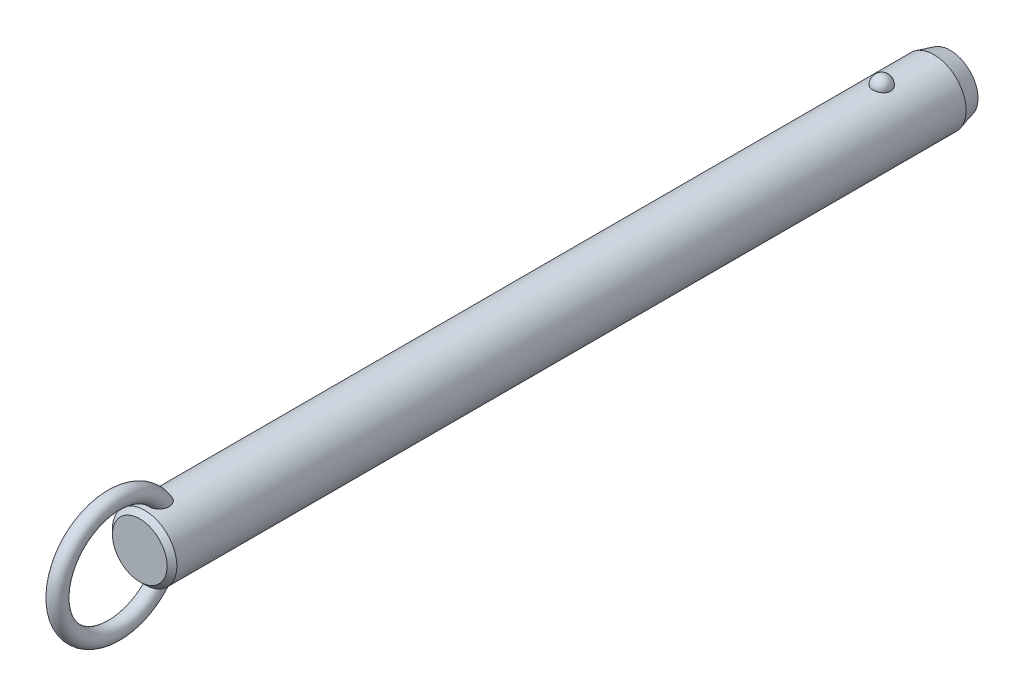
SolidWorks part; units mm, degrees
ref_plane "Front Plane" through (0, 0, 0) normal (0, 0, 1) x (1, 0, 0)
ref_plane "Top Plane" through (0, 0, 0) normal (0, 1, 0) x (1, 0, 0)
ref_plane "Right Plane" through (0, 0, 0) normal (1, 0, 0) x (0, 0, -1)
sketch "Sketch2" plane through (0, 0, 0) normal (0, 0, 1) x (1, 0, 0)
  circle A0 centre (0, 0) radius 7.9
  point P3 (0, 7.9)
  dimension "D1" = 15.8
extrude "Boss-Extrude1" add sketch "Sketch2" along normal blind 170.2
sketch "Sketch3" plane through (0, 0, 0) normal (0, 0, -1) x (-1, 0, 0)
  circle A0 centre (0, 0) radius 7.9
  dimension "D1" = 15.8
extrude "Boss-Extrude2" add sketch "Sketch3" along normal blind 19
chamfer "Chamfer1" distance 4 angle 15 1 edges at (-7.9, 0, -19)
sketch "Sketch12" plane through (0, 0, 0) normal (1, 0, 0) x (0, 0, -1)
  line L0 (-170.2, 7.9) -> (-170.2, -7.9) construction
  point P0 (-170.2, 0)
sketch "Sketch13" plane through (0, 0, 0) normal (1, 0, 0) x (0, 0, -1)
  circle A0 centre (-186.05, 0) radius 15.85
  point P2 (-170.2, 0)
  dimension "D1" = 31.7
sketch "Sketch14" plane through (0, 0, 0) normal (0, 1, 0) x (1, 0, 0)
  circle A0 centre (0, -172.2) radius 2
  point P2 (0, -170.2)
  dimension "D1" = 4
sweep "Sweep1" add profiles "Sketch14" path "Sketch13"
sketch "Sketch15" plane through (0, 0, 170.2) normal (0, 0, 1) x (1, 0, 0)
  circle A0 centre (0, 0) radius 7.9
  dimension "D1" = 15.8
extrude "Boss-Extrude3" add sketch "Sketch15" along normal blind 9.52
chamfer "Chamfer2" distance 1.2 angle 45 1 edges at (7.9, 0, 179.72)
sketch "Sketch18" plane through (0, 0, 0) normal (1, 0, 0) x (0, 0, -1)
  line L0 (15, 7.9) -> (-172.3091, 7.9) construction
  line L1 (2.2, 10.1) -> (2.2, 5.7)
  line L2 (-172.3091, -7.9) -> (15, -7.9) construction
  arc A0 (2.2, 10.1) -> (2.2, 5.7) centre (2.2, 7.9) ccw
  point P4 (0, 7.9)
  dimension "D1" = 18
revolve "Revolve1" add sketch "Sketch18" angle 360 about L1
